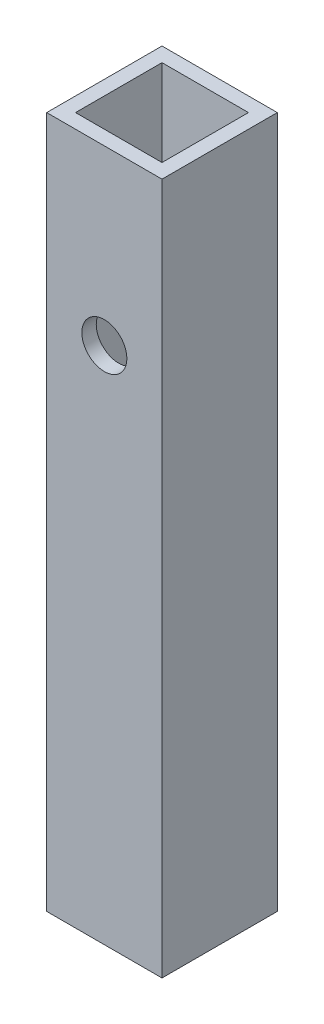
SolidWorks part; units mm, degrees
ref_plane "Front Plane" through (0, 0, 0) normal (0, 0, 1) x (1, 0, 0)
ref_plane "Top Plane" through (0, 0, 0) normal (0, 1, 0) x (1, 0, 0)
ref_plane "Right Plane" through (0, 0, 0) normal (1, 0, 0) x (0, 0, -1)
sketch "Sketch1" plane through (0, 0, 0) normal (0, 1, 0) x (1, 0, 0)
  line L0 (-19.05, -19.05) -> (-19.05, 19.05)
  line L1 (-25.4, -25.4) -> (25.4, -25.4)
  line L2 (-25.4, -25.4) -> (-25.4, 25.4)
  line L3 (-25.4, 25.4) -> (25.4, 25.4)
  line L4 (25.4, -25.4) -> (25.4, 25.4)
  line L5 (-19.05, 19.05) -> (19.05, 19.05)
  line L6 (19.05, -19.05) -> (19.05, 19.05)
  line L7 (-19.05, -19.05) -> (19.05, -19.05)
  dimension "D1" = 25.4
  dimension "D2" = 25.4
  dimension "D3" = 50.8
  dimension "D4" = 50.8
  dimension "D5" = 6.35
extrude "Extrude1" add sketch "Sketch1" against normal blind 304.8
sketch "Sketch2" plane through (0, 0, -25.4) normal (0, 0, -1) x (-1, 0, 0)
  circle A0 centre (0, -76.2) radius 9.9187
  dimension "D1" = 19.8374
  dimension "D2" = 76.2
extrude "Cut-Extrude1" cut sketch "Sketch2" against normal through all
